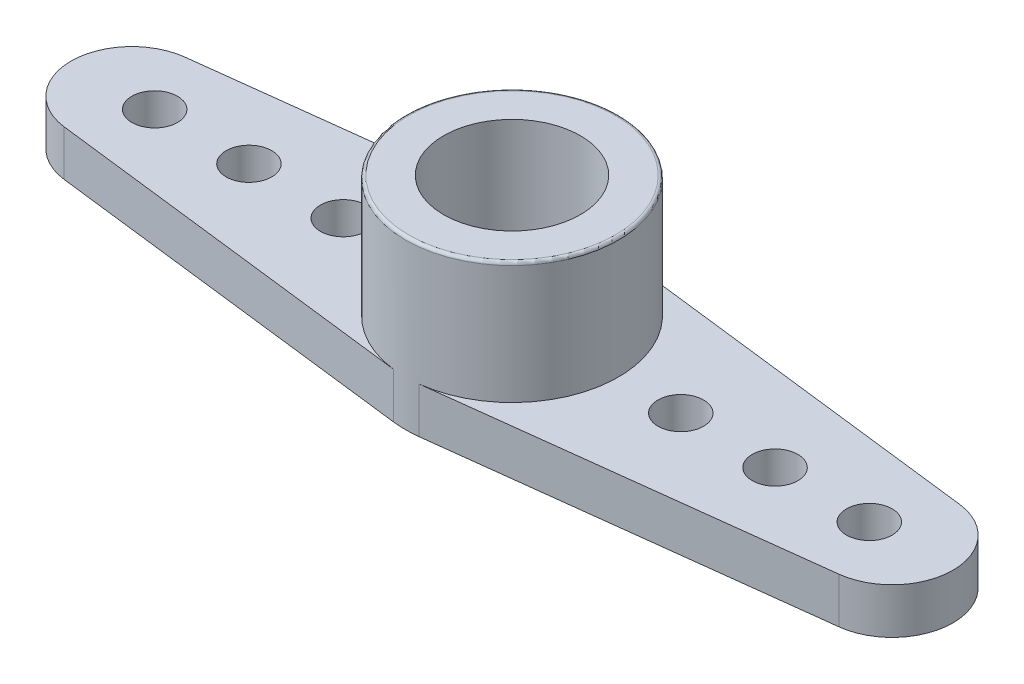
SolidWorks part; units mm, degrees
ref_plane "Front Plane" through (0, 0, 0) normal (0, 0, 1) x (1, 0, 0)
ref_plane "Top Plane" through (0, 0, 0) normal (0, 1, 0) x (1, 0, 0)
ref_plane "Right Plane" through (0, 0, 0) normal (1, 0, 0) x (0, 0, -1)
sketch "Sketch1" plane through (0, 0, 0) normal (0, 1, 0) x (1, 0, 0)
  line L0 (0, 0) -> (-14.5, 0) construction
  line L1 (-12.74, 1.9855) -> (-0.42, 3.4747)
  line L2 (-12.74, -1.9855) -> (-0.42, -3.4747)
  circle A0 centre (0, 0) radius 3.5
  circle A1 centre (0, 0) radius 2.25
  arc A2 (-12.74, 1.9855) -> (-12.74, -1.9855) centre (-12.5, 0) ccw
  circle A3 centre (-11.75, 0) radius 0.75
  circle A4 centre (-8.65, 0) radius 0.75
  circle A5 centre (-5.55, 0) radius 0.75
  point P7 (3.5, 0)
  point P13 (-12.5, 0)
  point P16 (-11, 0)
  point P17 (-9.4, 0)
  point P20 (-7.9, 0)
  point P21 (-6.3, 0)
  dimension "D1" = 7
  dimension "D2" = 4.5
  dimension "D3" = 4
  dimension "D5" = 1.5
  dimension "D4" = 18
  dimension "D6" = 2
  dimension "D7" = 1.6
  dimension "D8" = 1.6
extrude "Boss-Extrude1" add sketch "Sketch1" along normal blind 1.5
mirror "Mirror1" about plane through (0, 0, 0) normal (1, 0, 0) of "Boss-Extrude1"
sketch "Sketch2" plane through (0, 1.5, 0) normal (0, 1, 0) x (1, 0, 0)
  circle A5 centre (0, 0) radius 2.25
  circle A6 centre (0, 0) radius 2.25
  circle A7 centre (0, 0) radius 3.5
  circle A8 centre (0, 0) radius 3.5
  dimension "D3" = 0
  dimension "D4" = 0
extrude "Boss-Extrude2" add sketch "Sketch2" along normal blind 4
sketch "Sketch3" plane through (0, 0, 0) normal (0, -1, 0) x (1, 0, 0)
  circle A0 centre (0, 0) radius 2.625
  circle A1 centre (0, 0) radius 2.425
  dimension "D1" = 5.25
  dimension "D2" = 0.2
extrude "Boss-Extrude3" add sketch "Sketch3" along normal blind 0.2
fillet "Fillet1" radius 0.1 2 edges at (0, -0.2, -2.425) (0, -0.2, -2.625)
fillet "Fillet2" radius 0.1 1 edges at (0, 5.5, 3.5)
sketch "Sketch4" plane through (0, 0, 0) normal (0, -1, 0) x (1, 0, 0)
  circle A0 centre (0, 0) radius 1
  dimension "D1" = 2
extrude "Cut-Extrude1" cut sketch "Sketch4" against normal through all
